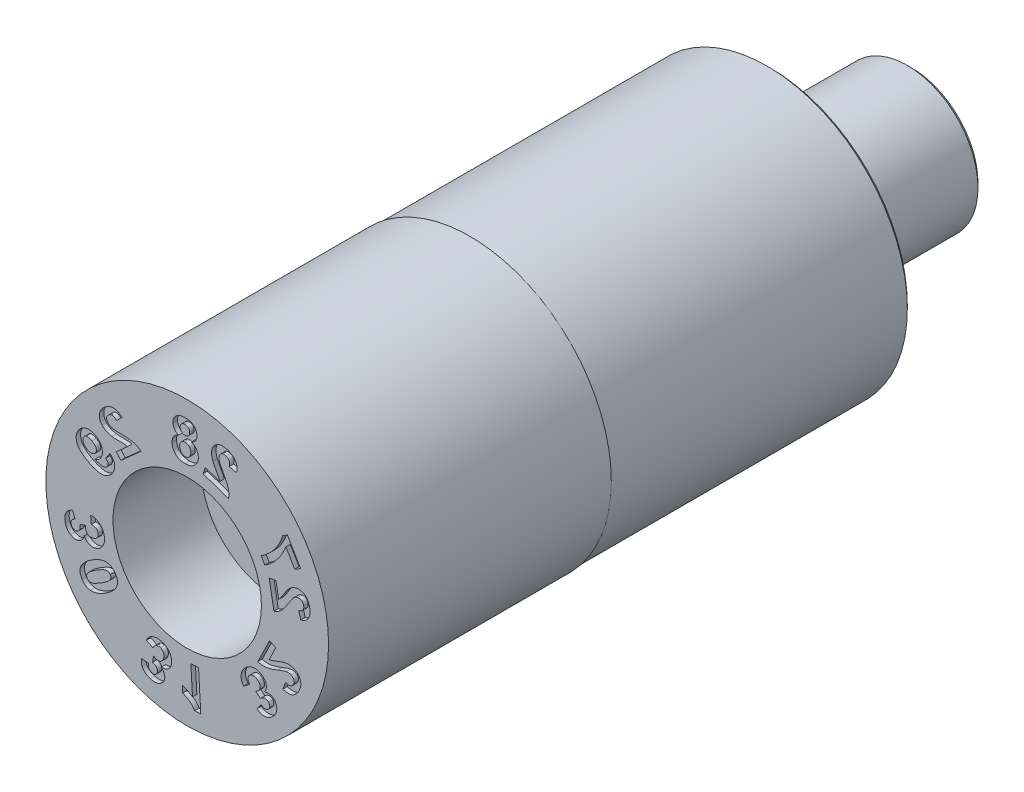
SolidWorks part; units mm, degrees
other "<M8 X 1.25 SHSS>-<Revolve1>"
ref_plane "Front Plane" through (0, 0, 0) normal (0, 0, 1) x (1, 0, 0)
ref_plane "Top Plane" through (0, 0, 0) normal (0, 1, 0) x (1, 0, 0)
ref_plane "Right Plane" through (0, 0, 0) normal (1, 0, 0) x (0, 0, -1)
sketch "Sketch1" plane through (0, 0, 0) normal (1, 0, 0) x (0, 0, -1)
  line L2 (0, 8) -> (0, 4.2)
  line L3 (32.75, 8) -> (0, 8)
  line L4 (-3.7979, 0) -> (49996.2021, 0) construction
  line L8 (25, 1.75) -> (5, 1.75)
  line L9 (5, 4.2) -> (5, 1.75)
  line L10 (5, 4.2) -> (0, 4.2)
  line L12 (33, 4) -> (33, 7.75)
  line L16 (33, 7.75) -> (32.75, 8)
  line L17 (33, 4) -> (25, 4)
  line L18 (25, 1.75) -> (25, 4)
  dimension "D1" = 33
  dimension "D2" = 45
  dimension "D3" = 0.25
  dimension "D4" = 16
  dimension "D5" = 8.4
  dimension "D6" = 5
  dimension "D7" = 3.5
  dimension "D8" = 8
  dimension "D9" = 8
revolve "Revolve1" add sketch "Sketch1" angle 360 about L4
sketch "Sketch4" plane through (0, 0, 0) normal (1, 0, 0) x (0, 0, -1)
  line L0 (0, 0) -> (50000, 0) construction
  line L1 (33, -7.75) -> (33, 7.75) construction
  line L2 (16, 8.935) -> (33, 8.935)
  line L3 (16, 8.935) -> (16, 7.935)
  line L4 (16, 7.935) -> (33, 7.935)
  line L5 (33, 8.935) -> (33, 7.935)
  line L6 (32.75, 8) -> (0, 8) construction
  line L9 (0, 8.8) -> (0, -8.8) construction
  dimension "D1" = 1
  dimension "D2" = 0.065
  dimension "D3" = 16
revolve "Cut-Revolve1" cut sketch "Sketch4" angle 360 about L0
sketch "Sketch2" plane through (0, 0, 0) normal (0, 0, 1) x (1, 0, 0)
  line L0 (0, 0) -> (0, 10.0042) construction
  line L1 (0, 0) -> (8.6639, 5.0021) construction
  line L2 (0, 0) -> (8.6639, -5.0021) construction
  line L3 (0, 0) -> (0, -10.0042) construction
  line L4 (0, 0) -> (-8.6639, -5.0021) construction
  line L5 (0, 0) -> (-8.6639, 5.0021) construction
  circle A0 centre (0, 0) radius 4.9201 construction
  text T0 "27  28  29  30  31  32" font "Arial" height 2.22
  point P11 (0, 0)
  point P1959 (0, 0.0125)
  point P1960 (0.0125, 0.0125)
  point P1961 (0.0125, 0)
  dimension "D1" = 6
extrude "Cut-Extrude1" cut sketch "Sketch2" against normal blind 0.25
sketch "Sketch3" plane through (0, 0, -5) normal (0, 0, 1) x (1, 0, 0)
  line L0 (0, 0) -> (0, 50000) construction
  line L1 (1.0104, 1.75) -> (-1.0104, 1.75)
  line L2 (-1.0104, 1.75) -> (-2.0207, 0)
  line L3 (-2.0207, 0) -> (-1.0104, -1.75)
  line L4 (-1.0104, -1.75) -> (1.0104, -1.75)
  line L5 (1.0104, -1.75) -> (2.0207, 0)
  line L6 (2.0207, 0) -> (1.0104, 1.75)
  line L7 (0, 0) -> (50000, 0) construction
  circle A0 centre (0, 0) radius 1.75 construction
  circle A1 centre (0, 0) radius 1.75 construction
extrude "Cut-Extrude2" cut sketch "Sketch3" against normal blind 4
inserted part "M8 X 1.25 SHSS"
move or copy body "Body-Move/Copy2" placed by mates yes
